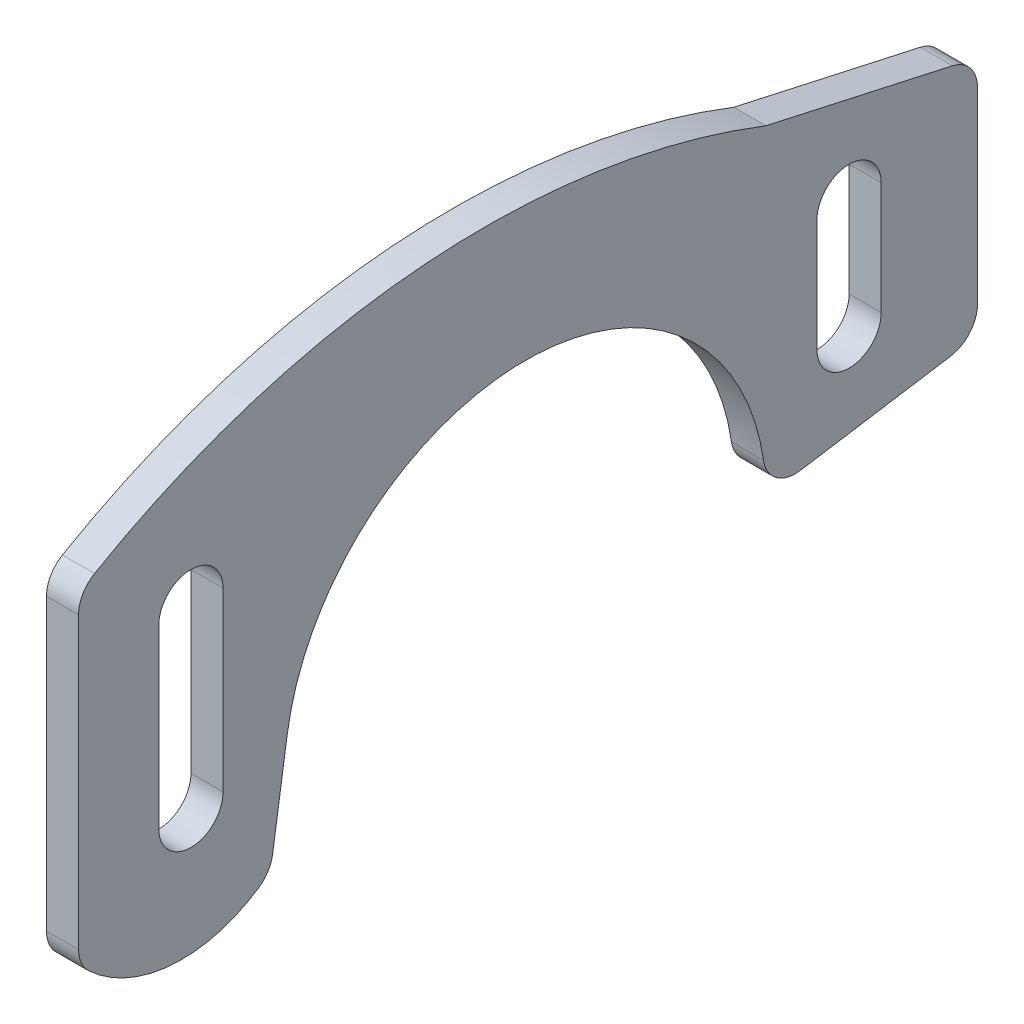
SolidWorks part; units mm, degrees
ref_plane "Plano frontal" through (0, 0, 0) normal (0, 0, 1) x (1, 0, 0)
ref_plane "Plano superior" through (0, 0, 0) normal (0, 1, 0) x (1, 0, 0)
ref_plane "Plano direito" through (0, 0, 0) normal (1, 0, 0) x (0, 0, -1)
sketch "Esboço1" plane through (0, 0, 0) normal (1, 0, 0) x (0, 0, -1)
  line L0 (0, -1.1353) -> (0, -19.1986)
  line L1 (12.0862, -20.1094) -> (13, -14.0805)
  line L2 (42.8297, 3.8336) -> (54.4321, 1.2665)
  line L3 (56, -0.6863) -> (56, -12.3723)
  line L4 (54.3129, -14.3477) -> (44.9623, -15.8287)
  line L5 (7, -4.1913) -> (7, -15.1913) construction
  line L6 (9, -4.1913) -> (9, -15.1913)
  line L7 (5, -4.1913) -> (5, -15.1913)
  line L8 (48, -2.829) -> (48, -9.829) construction
  line L9 (50, -2.829) -> (50, -9.829)
  line L10 (46, -2.829) -> (46, -9.829)
  line L11 (7, 3.5458) -> (7, -22.9283) construction
  line L12 (48, -15.3475) -> (48, 2.6896) construction
  arc A0 (0.6352, -20.6606) -> (11.239, -21.4596) centre (6.4355, -14.4471) ccw
  arc A1 (13, -14.0805) -> (42.6708, -14.1445) centre (27.8306, -16.3284) cw
  arc A2 (0.9956, 0.5943) -> (42.8297, 3.8336) centre (25.2755, -41.2154) cw
  arc A3 (42.6708, -14.1445) -> (44.9623, -15.8287) centre (44.6495, -13.8533) ccw
  arc A4 (56, -12.3723) -> (54.3129, -14.3477) centre (54, -12.3723) cw
  arc A5 (54.4321, 1.2665) -> (56, -0.6863) centre (54, -0.6863) cw
  arc A6 (0, -1.1353) -> (0.9956, 0.5943) centre (2, -1.1353) cw
  arc A7 (9, -4.1913) -> (5, -4.1913) centre (7, -4.1913) ccw
  arc A8 (5, -15.1913) -> (9, -15.1913) centre (7, -15.1913) ccw
  arc A9 (50, -2.829) -> (46, -2.829) centre (48, -2.829) ccw
  arc A10 (46, -9.829) -> (50, -9.829) centre (48, -9.829) ccw
  arc A11 (11.239, -21.4596) -> (12.0862, -20.1094) centre (10.1088, -19.8096) ccw
  arc A12 (0, -19.1986) -> (0.6352, -20.6606) centre (2, -19.1986) ccw
  point P14 (42.8297, -16.1664)
  point P17 (56, -14.0805)
  point P20 (56, 0.9195)
  point P23 (0, 0)
  point P26 (7, -9.6913)
  point P31 (48, -6.329)
  point P40 (11.9661, -20.9017)
  point P43 (0, -20)
  dimension "D1" = 15
  dimension "D9" = 2
  dimension "D12" = 11
  dimension "D13" = 15
  dimension "D16" = 2
  dimension "D17" = 8.5
  dimension "D2" = 12
  dimension "D3" = 13
  dimension "D4" = 20
  dimension "D5" = 56
  dimension "D6" = 15
  dimension "D7" = 20
  dimension "D8" = 81
  dimension "D10" = 4
  dimension "D11" = 4
  dimension "D14" = 5
  dimension "D15" = 6
  dimension "D18" = 14.4471
extrude "Ressalto-extrusão1" add sketch "Esboço1" along normal blind 2
